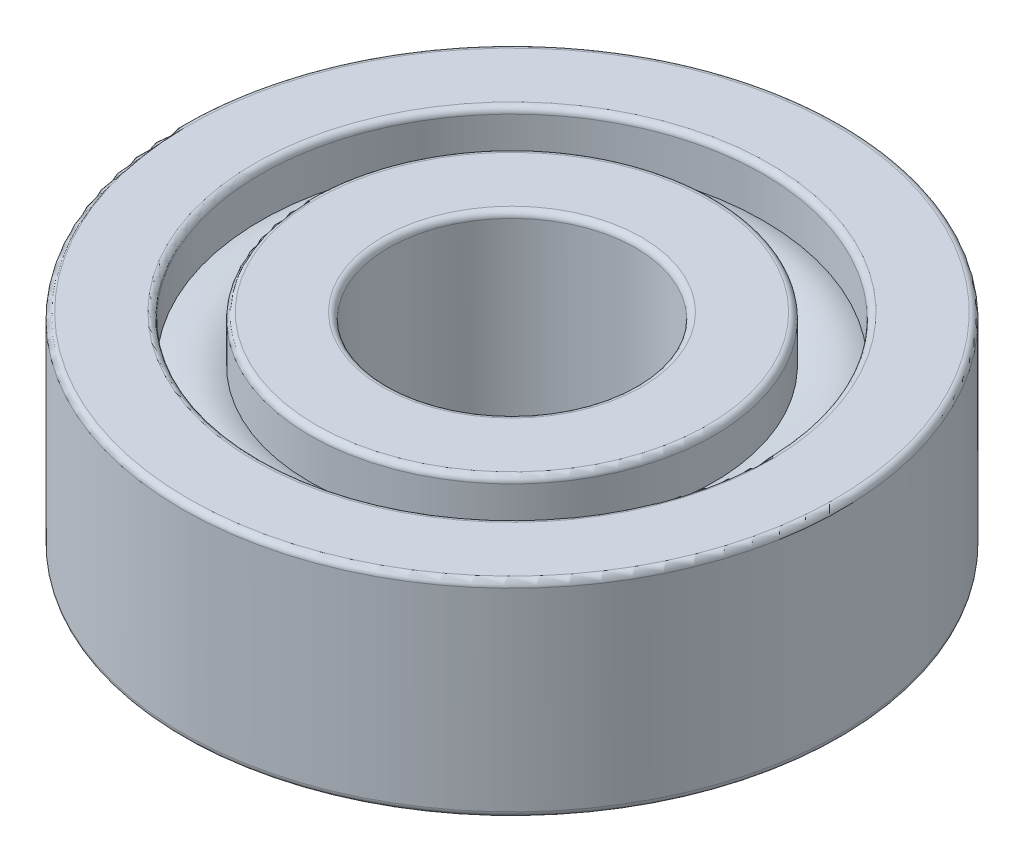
SolidWorks part; units mm, degrees
ref_plane "Face" through (0, 0, 0) normal (0, 0, 1) x (1, 0, 0)
ref_plane "Dessus" through (0, 0, 0) normal (0, 1, 0) x (1, 0, 0)
ref_plane "Droite" through (0, 0, 0) normal (1, 0, 0) x (0, 0, -1)
sketch "Esquisse1" plane through (0, 0, 0) normal (0, 0, 1) x (1, 0, 0)
  line L0 (0, 0) -> (0, 40.6841) construction
  line L1 (6, 0) -> (9.8, 0)
  line L2 (9.8, 0) -> (9.8, 2.2505)
  line L4 (12.2, 2.2505) -> (12.2, 0)
  line L5 (12.2, 0) -> (16, 0)
  line L6 (16, 0) -> (16, 10)
  line L7 (16, 10) -> (12.2, 10)
  line L8 (12.2, 10) -> (12.2, 7.7495)
  line L10 (9.8, 7.7495) -> (9.8, 10)
  line L11 (9.8, 10) -> (6, 10)
  line L12 (6, 10) -> (6, 0)
  arc A0 (12.2, 7.7495) -> (9.8, 7.7495) centre (11, 5) ccw
  arc A1 (9.8, 2.2505) -> (12.2, 2.2505) centre (11, 5) ccw
  dimension "D2" = 3
  dimension "D1" = 12
  dimension "D3" = 32
revolve "Révolution1" add sketch "Esquisse1" angle 360 about L0
fillet "Congé1" radius 0.3 8 edges at (0, 0, -6) (0, 0, -9.8) (0, 0, -12.2) (0, 0, -16) (0, 10, -9.8) (0, 10, -6) (0, 10, -16) (0, 10, -12.2)
